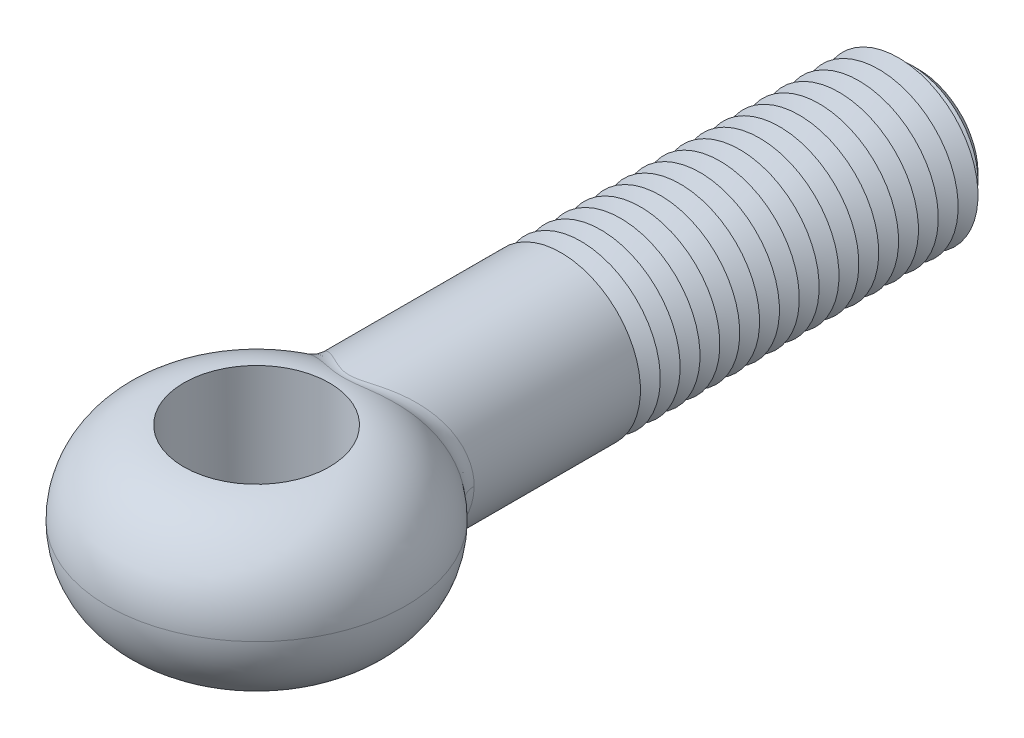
SolidWorks part; units mm, degrees
ref_plane "Front Plane" through (0, 0, 0) normal (0, 0, 1) x (1, 0, 0)
ref_plane "Top Plane" through (0, 0, 0) normal (0, 1, 0) x (1, 0, 0)
ref_plane "Right Plane" through (0, 0, 0) normal (1, 0, 0) x (0, 0, -1)
sketch "Sketch7" plane through (0, 0, 0) normal (0, 1, 0) x (1, 0, 0)
  circle A0 centre (0, 0) radius 22.5
  dimension "D1" = 45
extrude "Boss-Extrude3" add sketch "Sketch7" along normal mid plane 25
sketch "Sketch8" plane through (0, 0, 0) normal (0, 0, 1) x (1, 0, 0)
  circle A0 centre (0, 0) radius 12
  dimension "D1" = 24
extrude "Boss-Extrude4" add sketch "Sketch8" against normal blind 100
fillet "Fillet5" radius 12.5 2 edges at (0, -12.5, 22.5) (0, 12.5, 22.5)
fillet "Fillet6" radius 3.5 2 edges at (0.1915, -11.9985, -13.5039) (-0.1915, 11.9985, -13.5039)
chamfer "Chamfer1" distance 3 angle 45 1 edges at (12, 0, -100)
sketch "Sketch10" plane through (0, 0, 0) normal (0, 1, 0) x (1, 0, 0)
  line L0 (0, 28.1405) -> (0, -7.9233) construction
sketch "Sketch11" plane through (0, 0, 0) normal (0, 1, 0) x (1, 0, 0)
  line L0 (-12, 46) -> (-9.4019, 47.5)
  line L1 (-12, 97) -> (-12, 20.8746) construction
  line L2 (-9.4019, 47.5) -> (-12, 49)
  line L3 (-12, 49) -> (-12, 46)
  line L4 (9, 100) -> (-9, 100) construction
  dimension "D1" = 3
  dimension "D2" = 54
revolve "Cut-Revolve1" cut sketch "Sketch11" angle 360 about L0
pattern_linear "LPattern1" count 18 spacing 3 along (0, 0, -1) of "Cut-Revolve1"
sketch "Sketch12" plane through (0, 0, 0) normal (0, 1, 0) x (1, 0, 0)
  circle A0 centre (0, 0) radius 11
  dimension "D1" = 22
extrude "Cut-Extrude1" cut sketch "Sketch12" against normal mid plane 25
